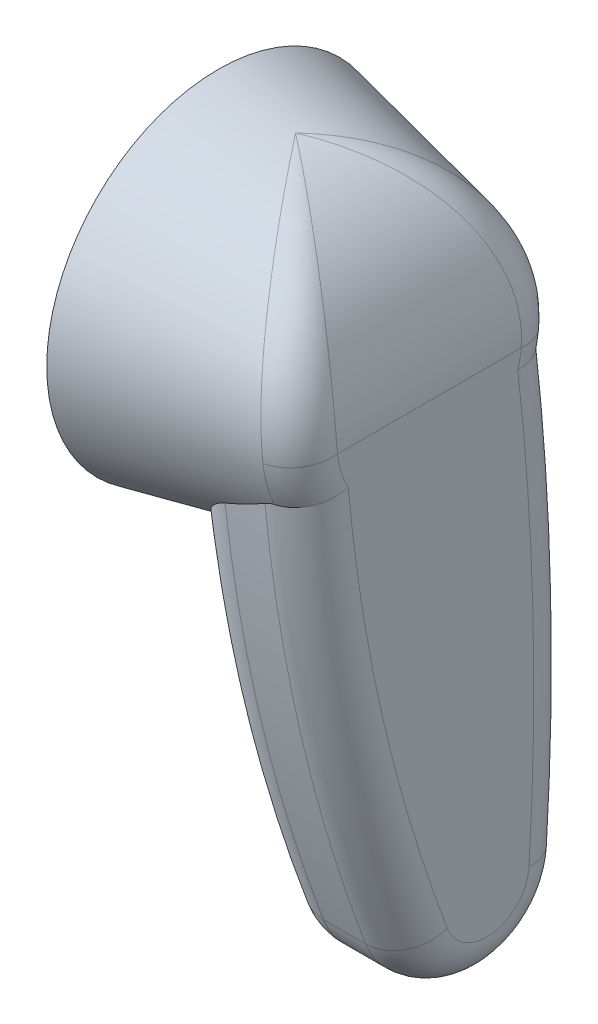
SolidWorks part; units mm, degrees
ref_plane "XY" through (0, 0, 0) normal (0, 0, 1) x (1, 0, 0)
ref_plane "YZ" through (0, 0, 0) normal (0, 1, 0) x (1, 0, 0)
ref_plane "XZ" through (0, 0, 0) normal (1, 0, 0) x (0, 0, -1)
ref_plane "Arm-plane" through (254, 0, 0) normal (1, 0, 0) x (0, 0, -1)
sketch "Sketch4" plane through (254, 0, 0) normal (1, 0, 0) x (0, 0, -1)
  line L0 (40.4939, -84.495) -> (5.9396, 192.7601) construction
  line L3 (272.0816, 0) -> (-272.0816, 0) construction
  arc A0 (81.5087, 202.5456) -> (-70.0871, 187.6243) centre (5.9396, 192.7601) ccw
  arc A1 (-70.0871, 187.6243) -> (-7.0382, -102.4211) centre (943.6027, 256.1009) ccw
  arc A2 (81.5087, 202.5456) -> (91.1962, -87.6443) centre (-1429.8725, 6.8342) cw
  arc A3 (-7.0382, -102.4211) -> (91.1962, -87.6443) centre (40.4939, -84.495) ccw
  dimension "D1" = 76.2
  dimension "D2" = 50.8
  dimension "D5" = 1524
  dimension "D6" = 1016
  dimension "D3" = 279.4
  dimension "D4" = 97.104
extrude "Base-Extrude" add sketch "Sketch4" along normal mid plane 76.2
sketch "Sketch5" plane through (292.1, 0, 0) normal (1, 0, 0) x (0, 0, -1)
  circle A0 centre (5.9396, 192.7601) radius 76.2
extrude "Boss-Extrude1" add sketch "Sketch5" against normal blind 127 draft 12
sketch "Sketch6" plane through (0, 0, 0) normal (0, 0, 1) x (1, 0, 0)
  line L0 (292.1, 268.9601) -> (165.1, 295.9547) construction
  line L1 (211.6238, 286.0658) -> (165.1, 295.9547)
  line L2 (292.1, -102.4211) -> (292.1, 187.6243) construction
  line L3 (292.1, -102.4211) -> (292.1, 186.686)
  arc A0 (292.1, 186.686) -> (211.6238, 286.0658) centre (190.5, 186.686) ccw
  dimension "D1" = 101.6
extrude "Cut-Extrude1" cut sketch "Sketch6" against normal through all and the other way through all flip side to cut
fillet "Fillet12" radius 25.4 8 edges at (292.1, 49.695, -93.5247) (285.7246, 172.6579, 68.965) (281.6797, 231.5058, -74.1134) (274.0844, 244.4459, 55.1608) (292.1, 39.8273, 49.1117) (292.1, -134.7298, -48.0504)
fillet "Fillet8" radius 25.4 4 edges at (215.9, 13.8171, 43.086) (215.9, 30.882, -93.9378) (215.9, -134.7298, -48.0504)
